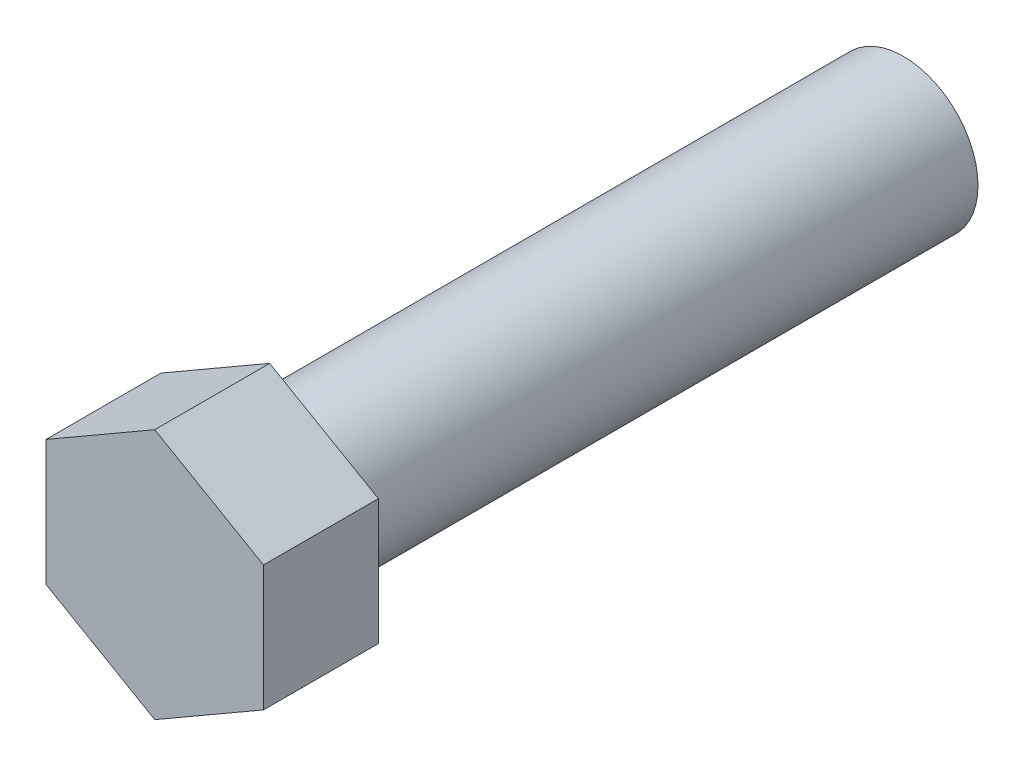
SolidWorks part; units mm, degrees
ref_plane "Front Plane" through (0, 0, 0) normal (1, 0, 0) x (0, 1, 0)
ref_plane "Top Plane" through (0, 0, 0) normal (0, 0, 1) x (0, 1, 0)
ref_plane "Right Plane" through (0, 0, 0) normal (0, 1, 0) x (-1, 0, 0)
sketch "Sketch1"
sketch_block_instance "W14x730-1-1"
sketch_block "W14x730-1" parameters "D4"=15.24, "D1"=454.406, "D2"=569.468, "D3"=77.978, "D5"=124.714, "D6"=533.4, "D7"=27.3509, "D8"=8374.3758, "D9"=3499.6788, "D10"=18059.4
sketch "sk body" plane through (0, 0, 0) normal (0, 0, 1) x (0, 1, 0)
  circle A0 centre (0, 0) radius 38.1
  dimension "D1" = 76.2
sketch "sk Max dia" plane through (0, 0, 0) normal (0, 0, 1) x (0, 1, 0)
  circle A0 centre (0, 0) radius 52.2097
  dimension "D1" = 104.4194
sketch "Sketch3" plane through (0, 0, 0) normal (0, 0, 1) x (0, 1, 0)
  line L1 (64.158, 0) -> (32.079, 55.5625)
  line L2 (32.079, 55.5625) -> (-32.079, 55.5625)
  line L3 (-32.079, 55.5625) -> (-64.158, 0)
  line L4 (-64.158, 0) -> (-32.079, -55.5625)
  line L5 (-32.079, -55.5625) -> (32.079, -55.5625)
  line L6 (32.079, -55.5625) -> (64.158, 0)
  circle A0 centre (0, 0) radius 55.5625 construction
  dimension "D1" = 111.125
extrude "bolt Head" add sketch "Sketch3" along normal blind 58.7375
extrude "bolt Body" add sketch "sk body" against normal blind 323.85
